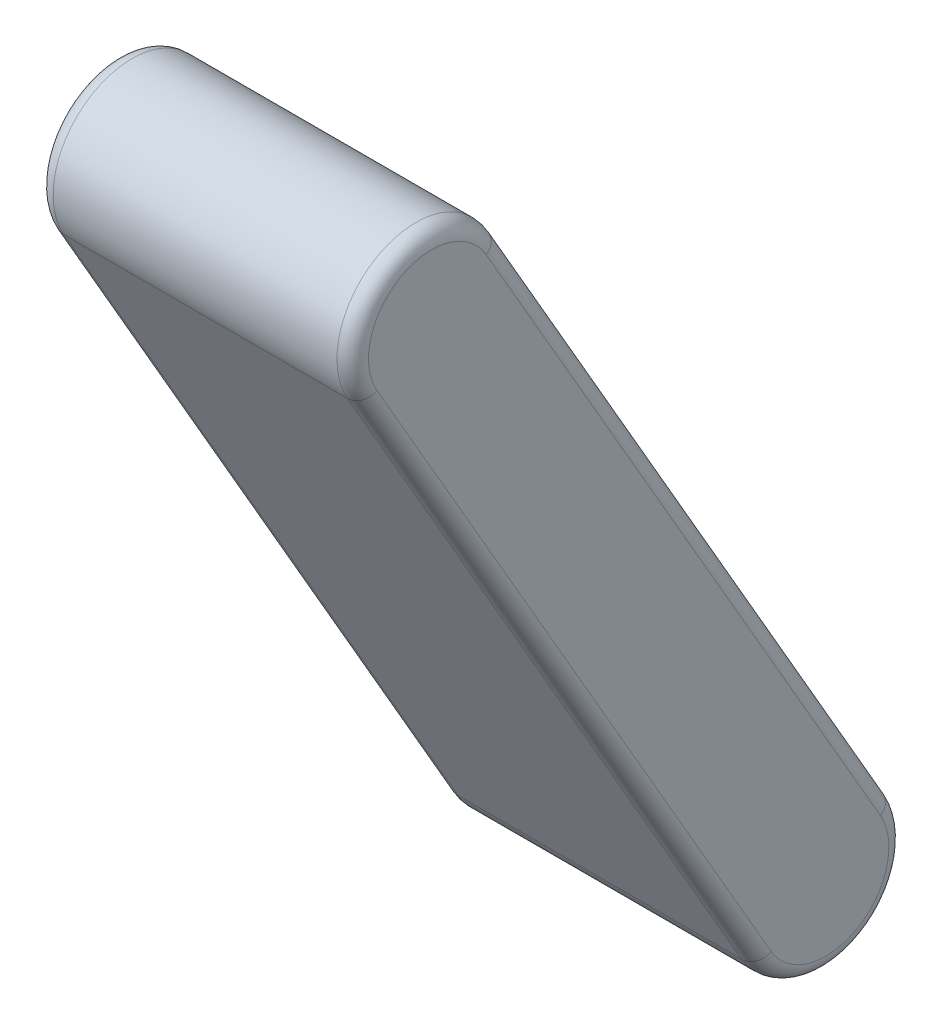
SolidWorks part; units mm, degrees
ref_plane "Front Plane" through (0, 0, 0) normal (0, 0, 1) x (1, 0, 0)
ref_plane "Top Plane" through (0, 0, 0) normal (0, 1, 0) x (1, 0, 0)
ref_plane "Right Plane" through (0, 0, 0) normal (1, 0, 0) x (0, 0, -1)
sketch "Sketch Construction-stander-sketch" plane through (0, 0, 0) normal (1, 0, 0) x (0, 0, -1)
  line L0 (13.8564, 8) -> (68.6809, 102.9587) construction
  line L2 (97.0141, 0.9753) -> (76.2644, 7.7529)
  line L3 (34.5263, 48.8013) -> (59.5263, 5.5) construction
  line L4 (68.1865, 10.5) -> (43.1865, 53.8013) construction
  line L5 (38.8564, 51.3013) -> (63.8564, 8) construction
  line L6 (13.8564, 8) -> (27.2643, 44.8378) construction
  line L7 (74.712, 8) -> (13.8564, 8) construction
  line L8 (0, 0) -> (73.5, 127.3057) construction
  line L9 (96.8589, 0) -> (0, 0) construction
  line L10 (25.5542, 40.1394) -> (63.8564, 8) construction
  line L11 (22.3402, 36.3092) -> (60.6425, 4.1698) construction
  line L12 (28.7681, 43.9696) -> (67.0703, 11.8302) construction
  line L13 (25.5542, 40.1394) -> (63.8564, 8) construction
  line L14 (27.1272, 34.4059) -> (59.2666, -3.8963) construction
  line L15 (30.9574, 37.6198) -> (63.0968, -0.6824) construction
  line L16 (11.9282, 20.6603) -> (10.1962, 21.6603)
  line L17 (29.6133, 51.2918) -> (38.8647, 76.7098) construction
  line L18 (30.9574, 37.6198) -> (63.0968, -0.6824) construction
  line L19 (27.1272, 34.4059) -> (59.2666, -3.8963) construction
  line L20 (34.7876, 40.8338) -> (66.927, 2.5315) construction
  line L22 (9.1962, 19.9282) -> (10.9282, 18.9282)
  line L23 (11.9282, 20.6603) -> (10.9282, 18.9282)
  arc A0 (97.0141, 0.9753) -> (96.8589, 0) centre (96.8589, 0.5) cw
  circle A1 centre (13.8564, 8) radius 8 construction
  arc A2 (76.2644, 7.7529) -> (74.712, 8) centre (74.712, 3) ccw
  arc A4 (73.5, 127.3057) -> (75.3657, 126.7822) centre (74.366, 126.8057) cw construction
  arc A5 (59.5263, 5.5) -> (68.1865, 10.5) centre (63.8564, 8) ccw construction
  arc A6 (43.1865, 53.8013) -> (34.5263, 48.8013) centre (38.8564, 51.3013) ccw construction
  circle A7 centre (13.8564, 8) radius 3 construction
  circle A8 centre (13.8564, 8) radius 2.5 construction
  circle A9 centre (13.8564, 8) radius 8.5 construction
  arc A10 (60.6425, 4.1698) -> (67.0703, 11.8302) centre (63.8564, 8) ccw construction
  arc A11 (28.7681, 43.9696) -> (22.3402, 36.3092) centre (25.5542, 40.1394) ccw construction
  arc A12 (59.2666, -3.8963) -> (66.927, 2.5315) centre (63.0968, -0.6824) ccw construction
  arc A13 (9.1962, 19.9282) -> (10.1962, 21.6603) centre (9.6962, 20.7942) cw
  arc A14 (68.6809, 102.9587) -> (75.3657, 126.7822) centre (25.3796, 127.9587) ccw construction
  arc A16 (27.1272, 34.4059) -> (34.7876, 40.8338) centre (30.9574, 37.6198) cw construction
  point P4 (100, 0)
  point P8 (30.9574, 37.6198)
  point P10 (68.6809, 102.9587)
  dimension "D3" = 8
  dimension "D8" = 0.5
  dimension "D9" = 5
  dimension "D10" = 60
  dimension "D11" = 1
  dimension "D5" = 10
  dimension "D12" = 8
  dimension "D20" = 147
  dimension "D24" = 50
  dimension "D29" = 2
  dimension "D6" = 2
  dimension "D4" = 34.202
  dimension "D2" = 60
  dimension "D7" = 100
  dimension "D16" = 70
  dimension "D17" = 70
  dimension "D25" = 34.202
  dimension "D26" = 70
  dimension "D23" = 8
  dimension "D13" = 5
  dimension "D14" = 0.5
  dimension "D15" = 0.5
  dimension "D18" = 5
  dimension "D19" = 5
  dimension "D27" = 5
  dimension "D28" = 5
sketch "width-stander-sketch" plane through (0, 0, 0) normal (0, 1, 0) x (1, 0, 0)
  line L0 (-40, 0) -> (40, 0) construction
  point P3 (29.95, 0)
  point P4 (-29.95, 0)
  dimension "D1" = 80
  dimension "D2" = 10.05
  dimension "D3" = 10.05
sketch "Sketch1-stander-sketch" plane through (0, 0, 0) normal (0, 1, 0) x (1, 0, 0)
  line L0 (40, 27.7937) -> (30, 72.7937)
  line L1 (-40, 0) -> (40, 0)
  line L2 (-40, 0) -> (-40, 27.7937)
  line L3 (-30, 72.7937) -> (30, 72.7937) construction
  line L4 (40, 0) -> (40, 27.7937)
  line L5 (-40, 27.7937) -> (-30, 72.7937)
  arc A0 (30, 72.7937) -> (-30, 72.7937) centre (0, 66.1271) ccw
  dimension "D1" = 10
  dimension "D2" = 45
inserted part "stander-sketch"
sketch "Sketch3" plane through (0, 0, 0) normal (1, 0, 0) x (0, 0, -1)
  line L0 (68.1865, 10.5) -> (43.1865, 53.8013) construction
  line L1 (34.5263, 48.8013) -> (59.5263, 5.5) construction
  line L2 (68.1865, 10.5) -> (43.1865, 53.8013)
  line L3 (34.5263, 48.8013) -> (59.5263, 5.5)
  arc A0 (43.1865, 53.8013) -> (34.5263, 48.8013) centre (38.8564, 51.3013) ccw construction
  arc A1 (59.5263, 5.5) -> (68.1865, 10.5) centre (63.8564, 8) ccw construction
  arc A2 (43.1865, 53.8013) -> (34.5263, 48.8013) centre (38.8564, 51.3013) ccw
  arc A3 (59.5263, 5.5) -> (68.1865, 10.5) centre (63.8564, 8) ccw
extrude "Boss-Extrude1" add sketch "Sketch3" along normal mid plane 20
fillet "Fillet1" radius 1 8 edges at (-10, 3.6699, -66.3564) (-10, 27.1506, -47.0263) (-10, 55.6314, -36.3564) (10, 3.6699, -66.3564) (10, 27.1506, -47.0263) (10, 55.6314, -36.3564) (-10, 32.1506, -55.6865) (10, 32.1506, -55.6865)
ref_plane "Plane2" through (0, 32.1506, -55.6865) normal (0, 0.5, -0.866) x (0, 0.866, 0.5)
sketch "Sketch5" plane through (0, 32.1506, -55.6865) normal (0, 0.5, -0.866) x (0, 0.866, 0.5)
  line L0 (-4.7197, 4.304) -> (3.8246, 4.304)
  line L32 (0.3313, -4.576) -> (-4.7197, -4.576)
  line L33 (-4.8874, -4.4083) -> (-4.8874, 4.1362)
  line L34 (3.9923, 4.1362) -> (3.9923, -0.9145)
  line L35 (3.8246, -1.0822) -> (3.1412, -1.0822)
  line L36 (2.9735, -0.9145) -> (2.9735, 3.1177)
  line L37 (2.8057, 3.2854) -> (-3.7009, 3.2854)
  line L38 (-3.8686, 3.1177) -> (-3.8686, -3.3894)
  line L39 (-3.7009, -3.5572) -> (0.3313, -3.5572)
  line L40 (0.499, -3.7249) -> (0.499, -4.4083)
  line L41 (5.5208, -4.4083) -> (5.5208, -3.7249)
  line L42 (5.353, -3.5572) -> (4.1601, -3.5572)
  line L43 (3.9923, -3.3894) -> (3.9923, -2.1965)
  line L44 (3.8246, -2.0287) -> (3.1412, -2.0287)
  line L45 (2.9735, -2.1965) -> (2.9735, -3.3894)
  line L46 (2.8057, -3.5572) -> (1.6128, -3.5572)
  line L47 (1.445, -3.7249) -> (1.445, -4.4083)
  line L48 (1.6128, -4.576) -> (2.8057, -4.576)
  line L49 (2.9735, -4.7438) -> (2.9735, -5.9367)
  line L50 (3.1412, -6.1044) -> (3.8246, -6.1044)
  line L51 (3.9923, -5.9367) -> (3.9923, -4.7438)
  line L52 (4.1601, -4.576) -> (5.353, -4.576)
  line L53 (1.8083, 1.2978) -> (1.8083, -0.477)
  line L54 (1.6405, -0.6448) -> (-1.5173, -0.6448)
  line L55 (-1.685, -0.8125) -> (-1.685, -1.5693)
  line L56 (-1.8528, -1.7371) -> (-2.5356, -1.7371)
  line L57 (-2.7034, -1.5693) -> (-2.7034, 1.2978)
  line L58 (-2.5356, 1.4656) -> (-1.8528, 1.4656)
  line L59 (-1.685, 1.2978) -> (-1.685, 0.5415)
  line L60 (-1.5173, 0.3738) -> (0.6217, 0.3738)
  line L61 (0.7894, 0.5415) -> (0.7894, 1.2978)
  line L62 (0.9572, 1.4656) -> (1.6405, 1.4656)
  arc A32 (2.8057, 3.2854) -> (2.9735, 3.1177) centre (2.8057, 3.1177) cw
  arc A33 (3.8246, 4.304) -> (3.9923, 4.1362) centre (3.8246, 4.1362) cw
  arc A34 (3.8246, -1.0822) -> (3.9923, -0.9145) centre (3.8246, -0.9145) ccw
  arc A35 (2.9735, -0.9145) -> (3.1412, -1.0822) centre (3.1412, -0.9145) ccw
  arc A36 (2.9735, -2.1965) -> (3.1412, -2.0287) centre (3.1412, -2.1965) cw
  arc A37 (3.8246, -2.0287) -> (3.9923, -2.1965) centre (3.8246, -2.1965) cw
  arc A38 (3.9923, -3.3894) -> (4.1601, -3.5572) centre (4.1601, -3.3894) ccw
  arc A39 (5.353, -3.5572) -> (5.5208, -3.7249) centre (5.353, -3.7249) cw
  arc A40 (5.353, -4.576) -> (5.5208, -4.4083) centre (5.353, -4.4083) ccw
  arc A41 (4.1601, -4.576) -> (3.9923, -4.7438) centre (4.1601, -4.7438) ccw
  arc A42 (3.9923, -5.9367) -> (3.8246, -6.1044) centre (3.8246, -5.9367) cw
  arc A43 (3.1412, -6.1044) -> (2.9735, -5.9367) centre (3.1412, -5.9367) cw
  arc A44 (1.6128, -4.576) -> (1.445, -4.4083) centre (1.6128, -4.4083) cw
  arc A45 (2.9735, -4.7438) -> (2.8057, -4.576) centre (2.8057, -4.7438) ccw
  arc A46 (2.8057, -3.5572) -> (2.9735, -3.3894) centre (2.8057, -3.3894) ccw
  arc A47 (1.445, -3.7249) -> (1.6128, -3.5572) centre (1.6128, -3.7249) cw
  arc A48 (0.499, -3.7249) -> (0.3313, -3.5572) centre (0.3313, -3.7249) ccw
  arc A49 (0.499, -4.4083) -> (0.3313, -4.576) centre (0.3313, -4.4083) cw
  arc A50 (-3.7009, -3.5572) -> (-3.8686, -3.3894) centre (-3.7009, -3.3894) cw
  arc A51 (-4.8874, -4.4083) -> (-4.7197, -4.576) centre (-4.7197, -4.4083) ccw
  arc A52 (-4.8874, 4.1362) -> (-4.7197, 4.304) centre (-4.7197, 4.1362) cw
  arc A53 (-3.8686, 3.1177) -> (-3.7009, 3.2854) centre (-3.7009, 3.1177) cw
  arc A54 (-2.5356, 1.4656) -> (-2.7034, 1.2978) centre (-2.5356, 1.2978) ccw
  arc A55 (-1.685, 1.2978) -> (-1.8528, 1.4656) centre (-1.8528, 1.2978) ccw
  arc A56 (-1.5173, 0.3738) -> (-1.685, 0.5415) centre (-1.5173, 0.5415) cw
  arc A57 (-1.685, -0.8125) -> (-1.5173, -0.6448) centre (-1.5173, -0.8125) cw
  arc A58 (-1.8528, -1.7371) -> (-1.685, -1.5693) centre (-1.8528, -1.5693) ccw
  arc A59 (-2.7034, -1.5693) -> (-2.5356, -1.7371) centre (-2.5356, -1.5693) ccw
  arc A60 (1.6405, -0.6448) -> (1.8083, -0.477) centre (1.6405, -0.477) ccw
  arc A61 (0.7894, 0.5415) -> (0.6217, 0.3738) centre (0.6217, 0.5415) cw
  arc A62 (0.9572, 1.4656) -> (0.7894, 1.2978) centre (0.9572, 1.2978) ccw
  arc A63 (1.6405, 1.4656) -> (1.8083, 1.2978) centre (1.6405, 1.2978) cw
extrude "Cut-Extrude1" cut sketch "Sketch5" against normal blind 0.5
